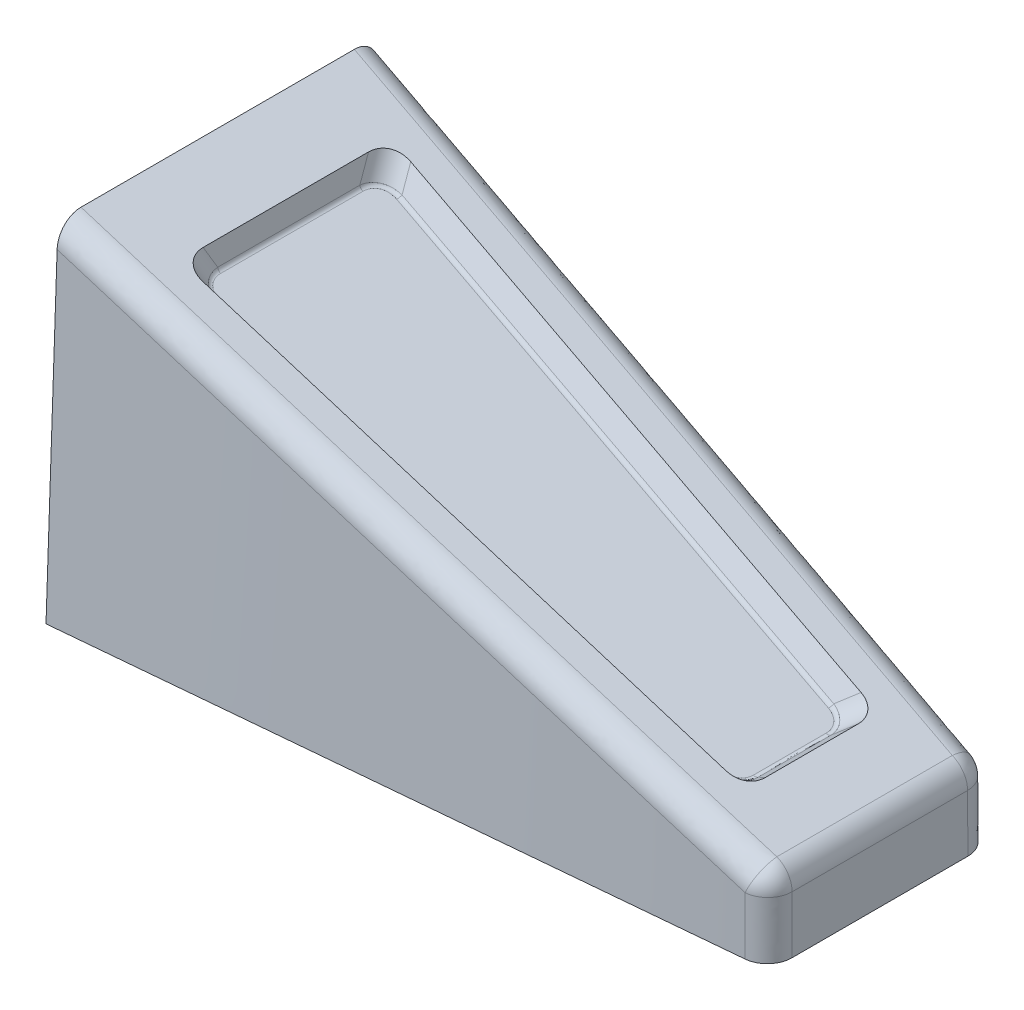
SolidWorks part; units mm, degrees
ref_plane "Front Plane" through (0, 0, 0) normal (0, 0, 1) x (1, 0, 0)
ref_plane "Top Plane" through (0, 0, 0) normal (0, 1, 0) x (1, 0, 0)
ref_plane "Right Plane" through (0, 0, 0) normal (1, 0, 0) x (0, 0, -1)
ref_plane "Plane1" through (135, 0, 0) normal (1, 0, 0) x (0, 0, -1)
sketch "Sketch1" plane through (135, 0, 0) normal (1, 0, 0) x (0, 0, -1)
  line L2 (-22.5, 0) -> (-22.5, 15)
  line L3 (-22.5, 15) -> (22.5, 15)
  line L4 (22.5, 0) -> (22.5, 15)
  dimension "D1" = 15
  dimension "D2" = 45
  dimension "D3" = 22.5
sketch "Sketch2" plane through (0, 0, 0) normal (1, 0, 0) x (0, 0, -1)
  line L1 (32.5555, 70) -> (-32.5555, 70)
  line L2 (32.5555, 70) -> (35, 0)
  line L3 (0, 0) -> (0, 84.7072) construction
  line L4 (-32.5555, 70) -> (-35, 0)
  point P7 (0, 70)
  dimension "D2" = 0
  dimension "D4" = 35
surface "Surface-Loft1"
other "Boundary-Surface1"
sketch "Sketch3" plane through (24.4588, 60.0353, 0) normal (0.3773, 0.9261, 0) x (0.9261, -0.3773, 0)
  line L2 (118.6748, -12.5237) -> (-27.099, -22.5793)
  line L3 (104.363, -13.5109) -> (-11.4108, -21.4971)
  line L5 (118.6748, 12.5237) -> (-27.099, 22.5793)
  line L6 (104.363, 13.5109) -> (-11.4108, 21.4971)
  line L8 (-11.4108, 32.5555) -> (-11.4108, -32.5555)
  line L9 (-11.4108, 21.4971) -> (-11.4108, -21.4971)
  line L11 (104.363, -22.5) -> (104.363, 22.5)
  line L12 (104.363, -13.5109) -> (104.363, 13.5109)
  dimension "D1" = 10
  dimension "D2" = 10
  dimension "D3" = 15
  dimension "D4" = 15
surface "Surface-Trim1"
other "Ruled Surface2" parameters "D1"=5, "D2"=30
surface "Surface-Fill1"
surface "Surface-Knit1"
fillet "Fillet1" radius 5 9 edges at (67.5, 42.5, -27.5278) (67.5, 42.5, 27.5278) (135, 15, 0) (135, 7.5, -22.5) (135, 7.5, 22.5) (14.2321, 61.8639, 20.1579) (119.1341, 19.126, 12.3442) (119.1341, 19.126, -12.3442) (14.2321, 61.8639, -20.1579)
fillet "Fillet2" radius 1 8 edges at (116.2735, 17.9536, 9.9547) (117.1596, 17.5926, 0) (115.9689, 18.0777, -10.307) (66.1422, 38.3775, -14.9775) (15.484, 59.016, -17.0832) (14.5729, 59.3872, 0) (16.1136, 58.7595, 17.7177) (66.1422, 38.3775, 14.9775)
